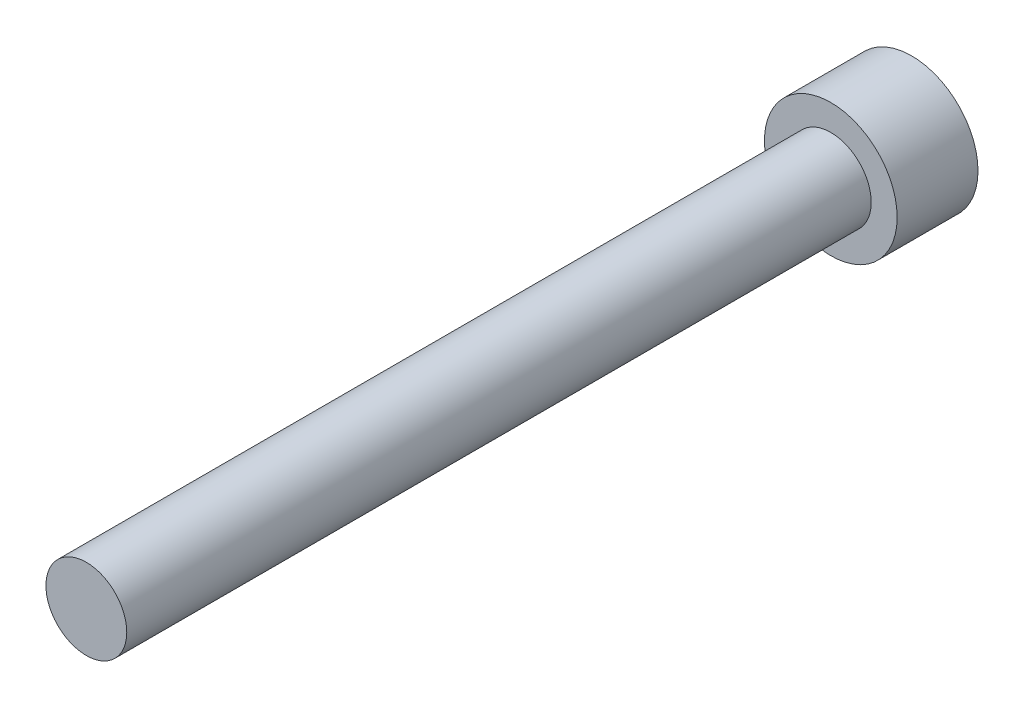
SolidWorks part; units mm, degrees
ref_plane "Front Plane" through (0, 0, 0) normal (0, 0, 1) x (1, 0, 0)
ref_plane "Top Plane" through (0, 0, 0) normal (0, 1, 0) x (1, 0, 0)
ref_plane "Right Plane" through (0, 0, 0) normal (1, 0, 0) x (0, 0, -1)
sketch "Sketch6" plane through (0, 0, 0) normal (1, 0, 0) x (0, 0, -1)
  line L0 (-44.45, 0) -> (22.525, 0) construction
  line L1 (4.3586, 0) -> (-4.3586, 0) construction
  line L2 (-44.45, 0) -> (-44.45, -2.413)
  line L3 (-44.45, -2.413) -> (0, -2.413)
  line L4 (0, 4.3586) -> (0, -4.3586) construction
  line L5 (0, -2.413) -> (0, -3.9624)
  line L6 (0, -3.9624) -> (4.826, -3.9624)
  line L7 (4.826, -3.9624) -> (4.826, 0)
  line L8 (4.826, 0) -> (-44.45, 0)
  dimension "L" = 44.45
  dimension "H" = 4.826
  dimension "A" = 7.9248
  dimension "D" = 4.826
revolve "Revolve1" add sketch "Sketch6" angle 360 about L0
sketch "Sketch7" plane through (0, 0, -4.826) normal (0, 0, -1) x (-1, 0, 0)
  line L2 (-1.9812, 1.1438) -> (-1.9812, -1.1438)
  line L4 (-1.9812, -1.1438) -> (0, -2.2877)
  line L5 (0, -2.2877) -> (1.9812, -1.1438)
  line L6 (1.9812, -1.1438) -> (1.9812, 1.1438)
  line L7 (1.9812, 1.1438) -> (0, 2.2877)
  line L8 (0, 2.2877) -> (-1.9812, 1.1438)
  circle A0 centre (0, 0) radius 1.9812 construction
  dimension "J" = 3.9624
extrude "HEX" cut sketch "Sketch7" against normal blind 3.048
